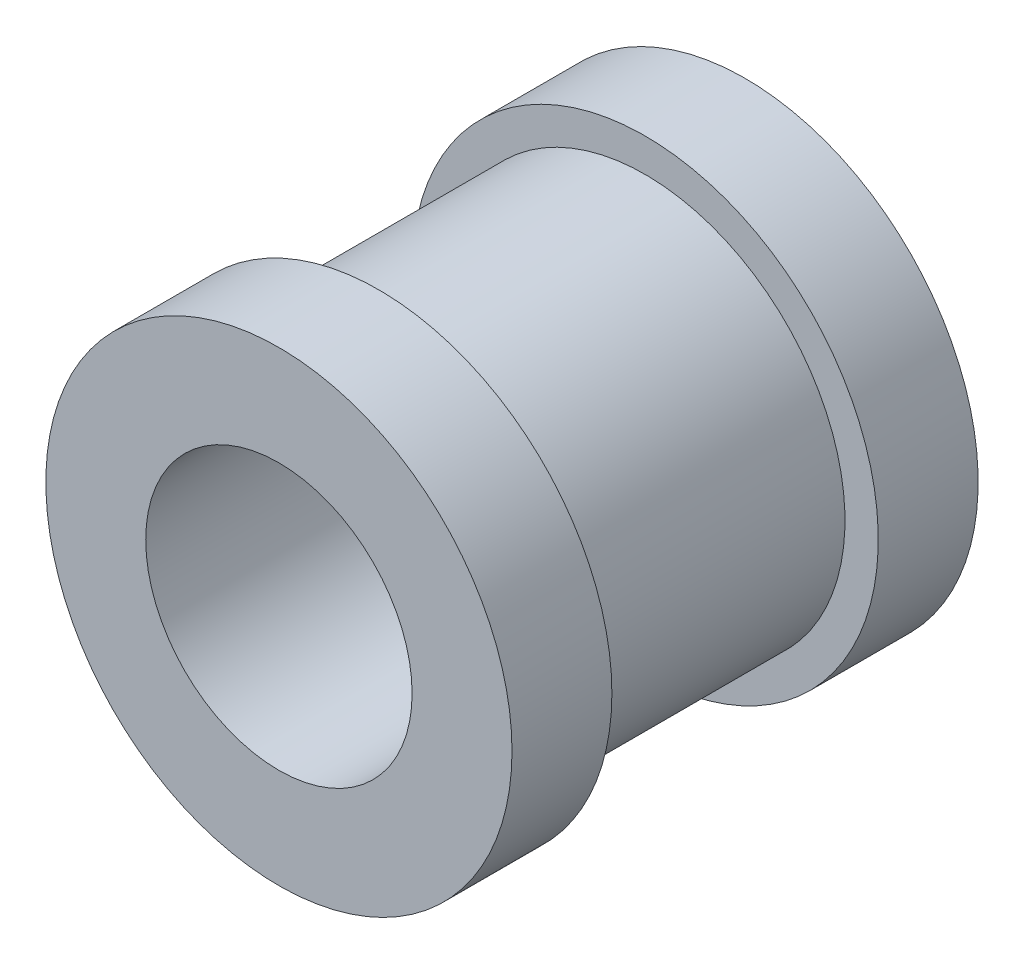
SolidWorks part; units mm, degrees
ref_plane "Front Plane" through (0, 0, 0) normal (0, 0, 1) x (1, 0, 0)
ref_plane "Top Plane" through (0, 0, 0) normal (0, 1, 0) x (1, 0, 0)
ref_plane "Right Plane" through (0, 0, 0) normal (1, 0, 0) x (0, 0, -1)
sketch "Sketch1" plane through (0, 0, 0) normal (0, 0, 1) x (1, 0, 0)
  circle A0 centre (0, 0) radius 6
  circle A1 centre (0, 0) radius 4
  dimension "D1" = 12
  dimension "D2" = 8
extrude "Boss-Extrude1" add sketch "Sketch1" along normal mid plane 14
sketch "Sketch2" plane through (0, 0, -7) normal (0, 0, -1) x (-1, 0, 0)
  circle A0 centre (0, 0) radius 7
  circle A1 centre (0, 0) radius 6
  dimension "D1" = 14
extrude "Boss-Extrude2" add sketch "Sketch2" against normal blind 3
sketch "Sketch3" plane through (0, 0, 7) normal (0, 0, 1) x (1, 0, 0)
  circle A0 centre (0, 0) radius 7
  circle A1 centre (0, 0) radius 6
extrude "Boss-Extrude3" add sketch "Sketch3" against normal blind 3 contours A0
